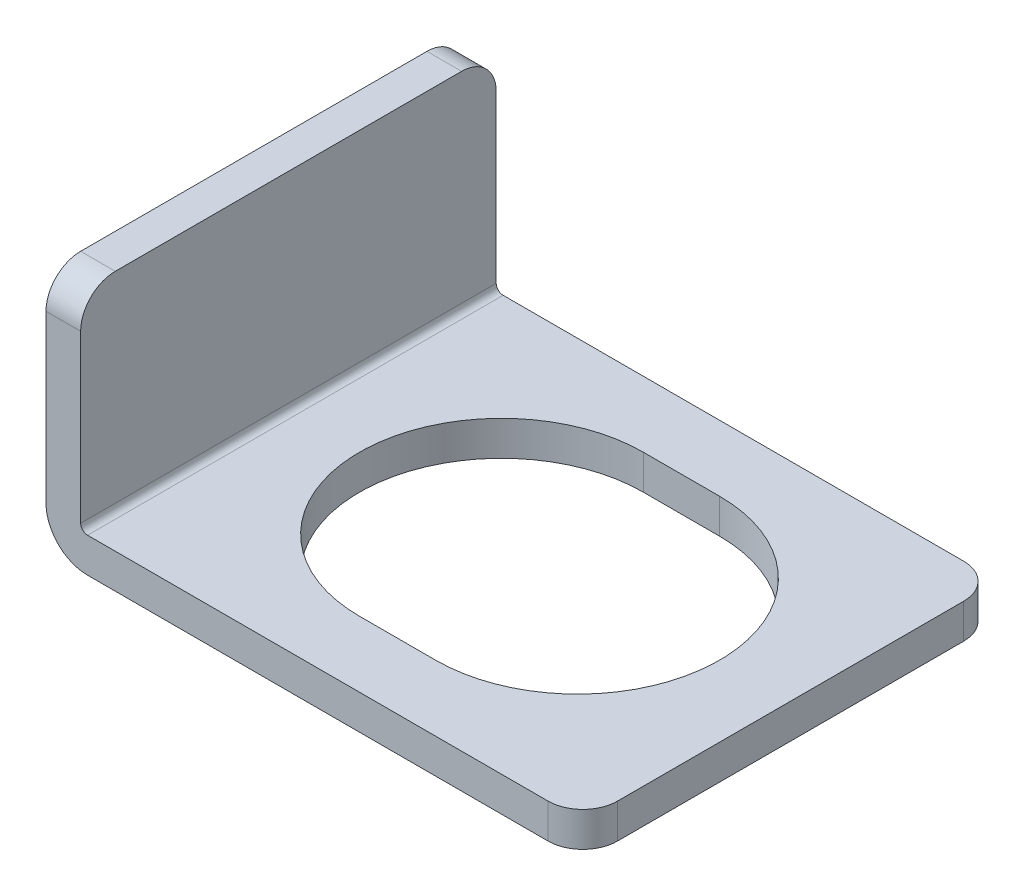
SolidWorks part; units mm, degrees
ref_plane "Front Plane" through (0, 0, 0) normal (0, 0, 1) x (1, 0, 0)
ref_plane "Top Plane" through (0, 0, 0) normal (0, 1, 0) x (1, 0, 0)
ref_plane "Right Plane" through (0, 0, 0) normal (1, 0, 0) x (0, 0, -1)
sketch "Sketch1" plane through (0, 0, 0) normal (0, 0, 1) x (1, 0, 0)
  line L0 (0, 1.2) -> (0, 7)
  line L1 (1.2, 0) -> (15.5, 0)
  line L2 (1.2, 1) -> (15.5, 1)
  line L3 (1, 1.2) -> (1, 7)
  line L4 (15.5, 1) -> (15.5, 0)
  line L5 (0, 7) -> (1, 7)
  arc A0 (1.2, 0) -> (0, 1.2) centre (1.2, 1.2) cw
  arc A1 (1.2, 1) -> (1, 1.2) centre (1.2, 1.2) cw
  point P6 (0, 0)
  dimension "D3" = 1.2
  dimension "D1" = 7
  dimension "D2" = 15.5
  dimension "D4" = 1
extrude "Boss-Extrude1" add sketch "Sketch1" along normal mid plane 12
sketch "Sketch2" plane through (0, 1, 0) normal (0, 1, 0) x (1, 0, 0)
  line L0 (7.15, 0) -> (9.35, 0) construction
  line L1 (7.15, 4.1) -> (9.35, 4.1)
  line L2 (7.15, -4.1) -> (9.35, -4.1)
  arc A0 (7.15, 4.1) -> (7.15, -4.1) centre (7.15, 0) ccw
  arc A1 (9.35, -4.1) -> (9.35, 4.1) centre (9.35, 0) ccw
  point P2 (8.25, 0)
  dimension "D1" = 8.25
  dimension "D2" = 8.2
  dimension "D3" = 2.2
extrude "Cut-Extrude1" cut sketch "Sketch2" against normal through all
fillet "Fillet1" radius 1 4 edges at (0.5, 7, -6) (15.5, 0.5, -6) (15.5, 0.5, 6) (0.5, 7, 6)
